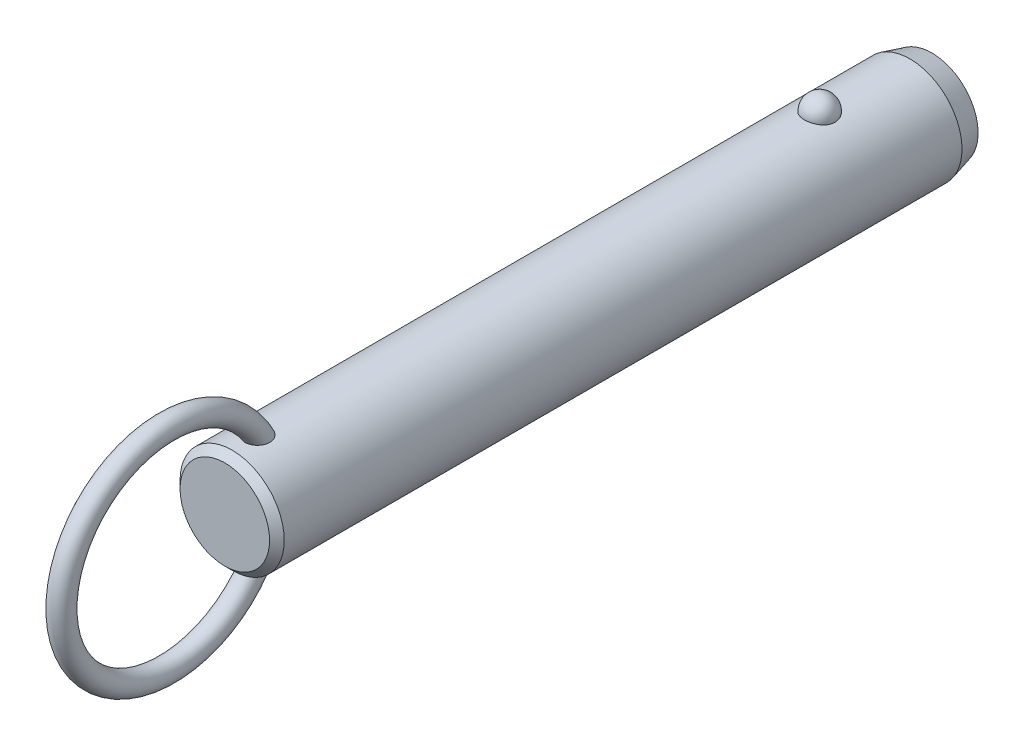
SolidWorks part; units mm, degrees
ref_plane "Front Plane" through (0, 0, 0) normal (0, 0, 1) x (1, 0, 0)
ref_plane "Top Plane" through (0, 0, 0) normal (0, 1, 0) x (1, 0, 0)
ref_plane "Right Plane" through (0, 0, 0) normal (1, 0, 0) x (0, 0, -1)
sketch "Sketch2" plane through (0, 0, 0) normal (0, 0, 1) x (1, 0, 0)
  circle A0 centre (0, 0) radius 7.1
  point P3 (0, 7.1)
  dimension "D1" = 14.2
extrude "Boss-Extrude1" add sketch "Sketch2" along normal blind 71.1
sketch "Sketch3" plane through (0, 0, 0) normal (0, 0, -1) x (-1, 0, 0)
  circle A0 centre (0, 0) radius 7.1
  dimension "D1" = 14.2
extrude "Boss-Extrude2" add sketch "Sketch3" along normal blind 17.4
chamfer "Chamfer1" distance 3 angle 15 1 edges at (-7.1, 0, -17.4)
sketch "Sketch12" plane through (0, 0, 0) normal (1, 0, 0) x (0, 0, -1)
  line L0 (-71.1, 7.1) -> (-71.1, -7.1) construction
  point P0 (-71.1, 0)
sketch "Sketch13" plane through (0, 0, 0) normal (1, 0, 0) x (0, 0, -1)
  circle A0 centre (-86.95, 0) radius 15.85
  point P2 (-71.1, 0)
  dimension "D1" = 31.7
sketch "Sketch14" plane through (0, 0, 0) normal (0, 1, 0) x (1, 0, 0)
  circle A0 centre (0, -72.6) radius 1.5
  point P2 (0, -71.1)
  dimension "D1" = 3
sweep "Sweep1" add profiles "Sketch14" path "Sketch13"
sketch "Sketch15" plane through (0, 0, 71.1) normal (0, 0, 1) x (1, 0, 0)
  circle A0 centre (0, 0) radius 7.1
  dimension "D1" = 14.2
extrude "Boss-Extrude3" add sketch "Sketch15" along normal blind 7.92
chamfer "Chamfer2" distance 1 angle 45 1 edges at (7.1, 0, 79.02)
sketch "Sketch18" plane through (0, 0, 0) normal (1, 0, 0) x (0, 0, -1)
  line L0 (14.4, 7.1) -> (-72.7792, 7.1) construction
  line L1 (2.1, 9.2) -> (2.1, 5)
  line L2 (-72.7792, -7.1) -> (14.4, -7.1) construction
  arc A0 (2.1, 9.2) -> (2.1, 5) centre (2.1, 7.1) ccw
  point P4 (0, 7.1)
  dimension "D1" = 16.3
revolve "Revolve1" add sketch "Sketch18" angle 360 about L1
